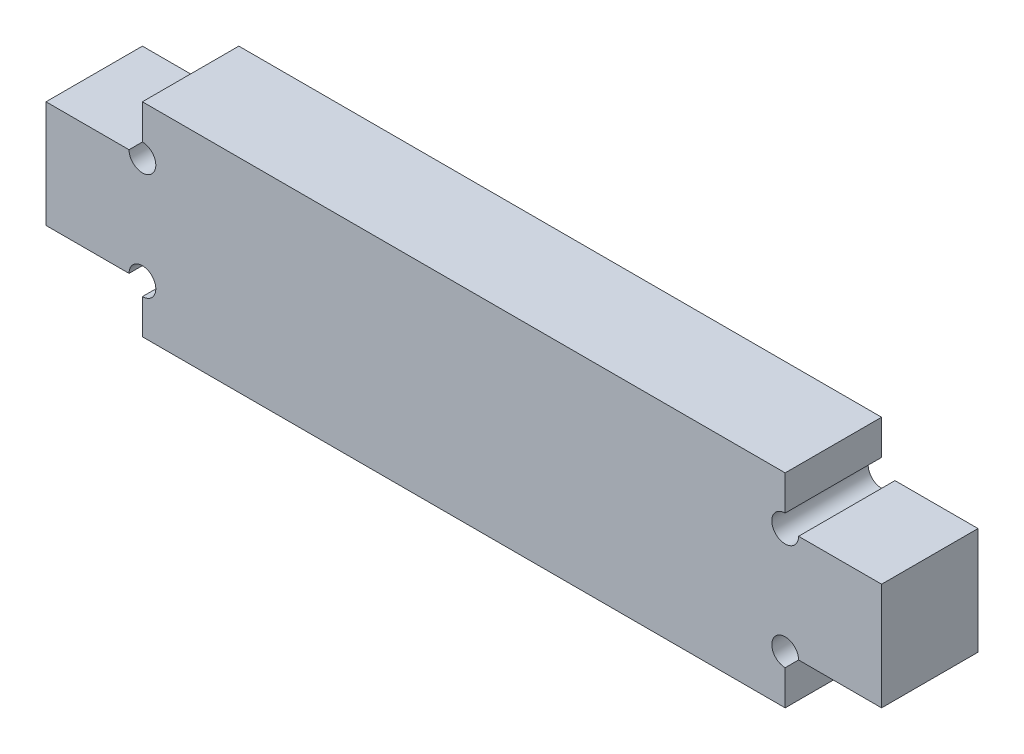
SolidWorks part; units mm, degrees
ref_plane "Front Plane" through (0, 0, 0) normal (0, 0, 1) x (1, 0, 0)
ref_plane "Top Plane" through (0, 0, 0) normal (0, 1, 0) x (1, 0, 0)
ref_plane "Right Plane" through (0, 0, 0) normal (1, 0, 0) x (0, 0, -1)
sketch "Sketch1" plane through (0, 0, 0) normal (0, 0, 1) x (1, 0, 0)
  line L0 (0, 0) -> (99.3876, 0) construction
  line L1 (-60, 19) -> (60, 19)
  line L2 (-60, 12.5) -> (-60, 19)
  line L3 (-60, -19) -> (60, -19)
  line L4 (60, -12.5) -> (60, -19)
  line L5 (78, -10) -> (62.5, -10)
  line L6 (-60, -12.5) -> (-60, -19)
  line L7 (78, -10) -> (78, 10)
  line L8 (-78, -10) -> (-62.5, -10)
  line L9 (-78, -10) -> (-78, 10)
  line L10 (-78, 10) -> (-62.5, 10)
  line L11 (0, 0) -> (0, 65.9672) construction
  line L12 (-78, -10) -> (-60, 0) construction
  line L13 (-78, 10) -> (-60, 0) construction
  line L14 (78, 10) -> (62.5, 10)
  line L15 (60, 12.5) -> (60, 19)
  arc A0 (-62.5, 10) -> (-60, 12.5) centre (-60, 10) ccw
  arc A1 (-60, -12.5) -> (-62.5, -10) centre (-60, -10) ccw
  arc A2 (60, -12.5) -> (62.5, -10) centre (60, -10) cw
  arc A3 (62.5, 10) -> (60, 12.5) centre (60, 10) cw
  point P0 (0, 0)
  point P7 (-60, 0)
  point P21 (0, -19)
  point P23 (-78, 0)
  point P31 (0, 19)
  dimension "D5" = 5
  dimension "D6" = 5
  dimension "D3" = 18
  dimension "D1" = 60
  dimension "D4" = 20
extrude "Boss-Extrude1" add sketch "Sketch1" along normal blind 18
sketch "Sketch2" plane through (0, 0, 18) normal (0, 0, 1) x (1, 0, 0)
  line L0 (0, 0) -> (0, 53.29) construction
  line L1 (-59.9826, 69) -> (-59.9826, 19)
  line L2 (-60, 19) -> (0, 19)
  line L3 (-59.9826, 69) -> (60.0174, 69)
  line L4 (60.0174, 69) -> (60, 19)
  line L5 (0, 0) -> (60.0174, 69) construction
  line L6 (-59.9826, 69) -> (0, 0) construction
  line L7 (60, 19) -> (-60, 19) construction
  line L8 (0, 53.29) -> (-52.7049, 53.29) construction
  line L9 (-60, 19) -> (-59.9826, 19)
  line L11 (0, 19) -> (60, 19)
  point P0 (0, 0)
  dimension "D1" = 34.29
  dimension "D2" = 50
  dimension "D3" = 120
extrude "Boss-Extrude2" [suppressed] add sketch "Sketch2" against normal up to surface (18 mm away) contours L4 L3 L1 M16
